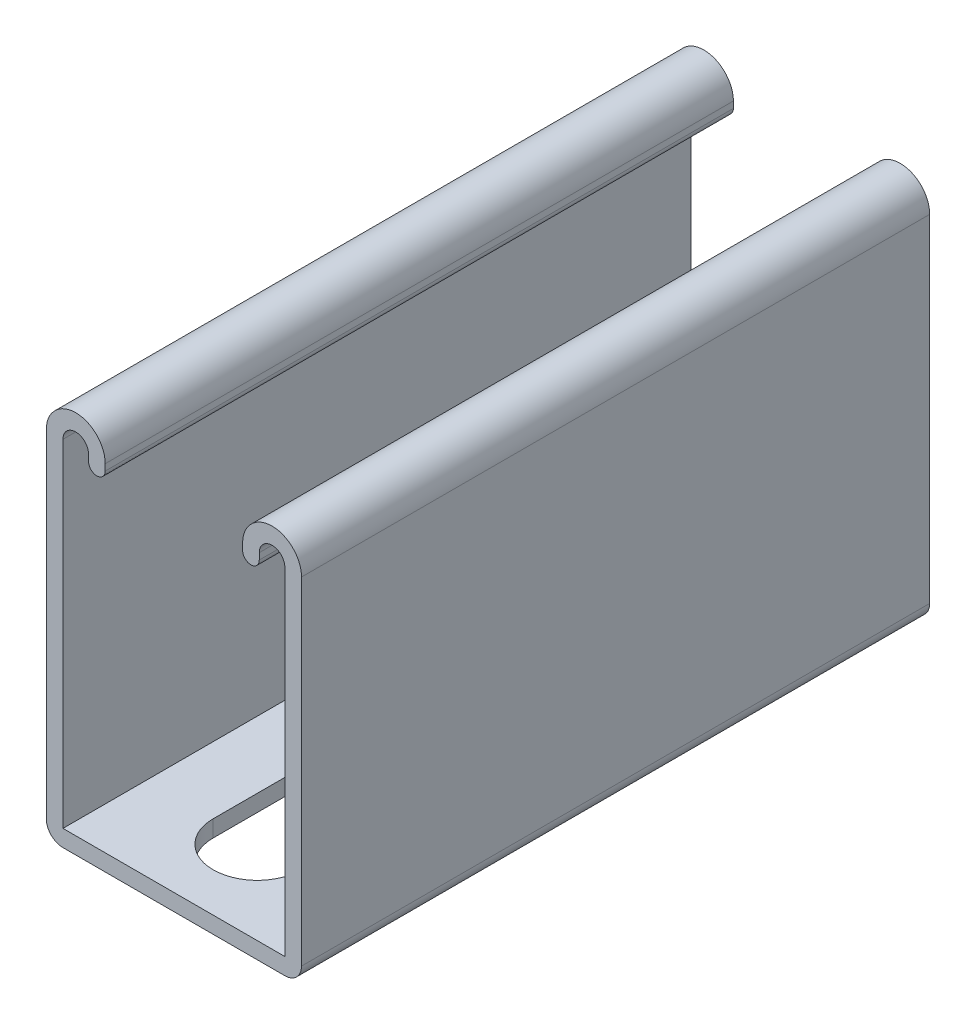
SolidWorks part; units mm, degrees
ref_plane "Plane1" through (0, 0, 0) normal (0, 0, 1) x (1, 0, 0)
ref_plane "Plane2" through (0, 0, 0) normal (0, 1, 0) x (1, 0, 0)
ref_plane "Plane3" through (0, 0, 0) normal (1, 0, 0) x (0, 0, -1)
sketch "Sketch1" plane through (0, 0, 0) normal (0, 0, 1) x (1, 0, 0)
  line L0 (-20.6375, 29.1719) -> (-20.6375, -25.3238)
  line L1 (-17.9451, -28.0162) -> (17.9451, -28.0162)
  line L2 (20.6375, -25.3238) -> (20.6375, 29.1719)
  line L3 (11.1125, 29.1719) -> (11.1125, 28.1369)
  line L4 (-11.1125, 29.1719) -> (-11.1125, 28.1369)
  line L5 (-13.8049, 29.1719) -> (-13.8049, 28.1369)
  line L6 (-17.9451, 29.1719) -> (-17.9451, -25.3238)
  line L7 (-17.9451, -25.3238) -> (17.9451, -25.3238)
  line L8 (17.9451, -25.3238) -> (17.9451, 29.1719)
  line L9 (13.8049, 29.1719) -> (13.8049, 28.1369)
  line L10 (-25.4, 33.9344) -> (25.4, 33.9344) construction
  line L11 (-12.8524, 26.7907) -> (12.8524, 26.7907) construction
  arc A0 (20.6375, 29.1719) -> (11.1125, 29.1719) centre (15.875, 29.1719) ccw
  arc A1 (-20.6375, 29.1719) -> (-11.1125, 29.1719) centre (-15.875, 29.1719) cw
  arc A2 (-17.9451, -28.0162) -> (-20.6375, -25.3238) centre (-17.9451, -25.3238) cw
  arc A3 (17.9451, -28.0162) -> (20.6375, -25.3238) centre (17.9451, -25.3238) ccw
  arc A4 (-17.9451, 29.1719) -> (-13.8049, 29.1719) centre (-15.875, 29.1719) cw
  arc A5 (17.9451, 29.1719) -> (13.8049, 29.1719) centre (15.875, 29.1719) ccw
  arc A6 (11.1125, 28.1369) -> (13.8049, 28.1369) centre (12.4587, 28.1369) ccw
  arc A7 (-11.1125, 28.1369) -> (-13.8049, 28.1369) centre (-12.4587, 28.1369) cw
  dimension "D1" = 2.6924
  dimension "D3" = 20.6375
  dimension "Width" = 41.275
  dimension "D5" = 28.0162
  dimension "D6" = 9.525
  dimension "D7" = 22.225
  dimension "D8" = 33.9344
  dimension "D9" = 7.1437
  dimension "gauge" = 2.6924
extrude "Base-Extrude" add sketch "Sketch1" along normal blind 101.6
extrude "Slot" cut sketch "Sketch2" against normal through all
sketch "Sketch2" plane through (-0.1869, -28.0162, -10.3696) normal (0, -1, 0) x (1, 0, 0)
  line L0 (7.3307, 47.6758) -> (7.3307, 33.3883)
  line L1 (-6.9568, 33.3883) -> (-6.9568, 47.6758)
  arc A0 (-6.9568, 33.3883) -> (7.3307, 33.3883) centre (0.1869, 33.3883) ccw
  arc A1 (7.3307, 47.6758) -> (-6.9568, 47.6758) centre (0.1869, 47.6758) ccw
  dimension "D3" = 14.2875
  dimension "D1" = 23.0188
  dimension "D2" = 14.2875
pattern_linear "LPattern1" count 2 spacing 50.8 along (0, 0, 1) of "Slot"
equation "\"D3@Sketch1\" = \"Width@Sketch1\" / 2"
equation "\"D7@Sketch1\" = \"Width@Sketch1\" - 2 * \"D6@Sketch1\""
equation "\"D1@Sketch1\" = \"gauge@Sketch1\""
equation "\"D1@LPattern1\" = \"D1@Base-Extrude\" / \"D3@LPattern1\""
